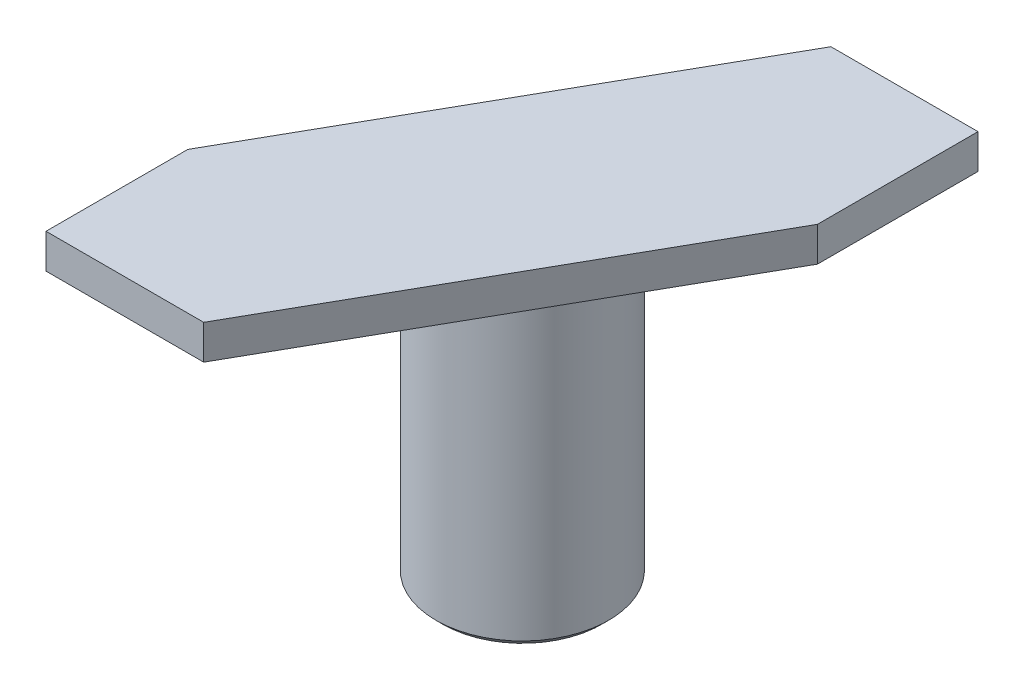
SolidWorks part; units mm, degrees
ref_plane "Płaszczyzna przednia" through (0, 0, 0) normal (0, 0, 1) x (1, 0, 0)
ref_plane "Płaszczyzna górna" through (0, 0, 0) normal (0, 1, 0) x (1, 0, 0)
ref_plane "Płaszczyzna prawa" through (0, 0, 0) normal (1, 0, 0) x (0, 0, -1)
sketch "Szkic1" plane through (0, 0, 0) normal (0, 1, 0) x (1, 0, 0)
  line L0 (1.1272, 4.6511) -> (5.3879, 4.6511)
  line L1 (5.3879, 4.6511) -> (5.3879, 0)
  line L2 (5.3879, 0) -> (-1.0435, -11.3489)
  line L3 (-1.0435, -11.3489) -> (-5.6121, -11.3489)
  line L4 (-5.6121, -11.3489) -> (-5.6121, -7.2411)
  line L5 (-5.6121, -7.2411) -> (1.1272, 4.6511)
  dimension "D1" = 6
  dimension "D2" = 16
  dimension "D3" = 11
extrude "Dodanie-wyciągnięcie1" add sketch "Szkic1" along normal blind 1
sketch "Szkic2" plane through (0, 0, 0) normal (0, 1, 0) x (1, 0, 0)
  circle A0 centre (0, -3.1619) radius 2.5
  dimension "D1" = 5
extrude "Dodanie-wyciągnięcie2" add sketch "Szkic2" against normal blind 9
sketch "Szkic3" plane through (0, -9, 0) normal (0, -1, 0) x (-1, 0, 0)
  line L0 (-1.463, -4.55) -> (-1.9032, -3.8269)
  line L1 (-1.9032, -3.8269) -> (1.4566, -1.7818)
  line L2 (1.4566, -1.7818) -> (1.8967, -2.5049)
  line L3 (1.8967, -2.5049) -> (-1.463, -4.55)
  point P2 (-1.6026, -4.6349)
extrude "Wytnij-wyciągnięcie1" cut sketch "Szkic3" against normal blind 1
chamfer "Sfazowanie1" distance 0.2 angle 45 1 edges at (0, -9, 5.6619)
